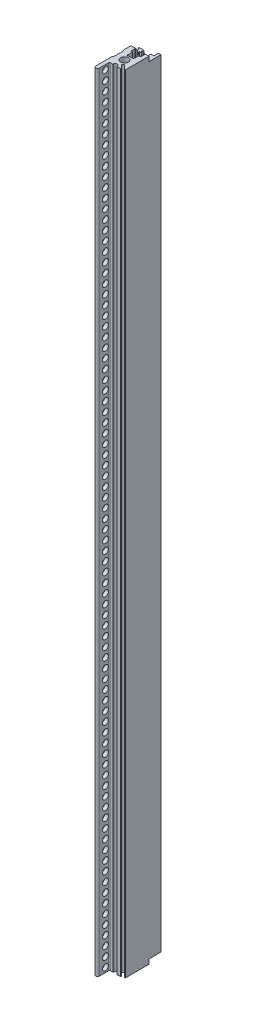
SolidWorks part; units mm, degrees
ref_plane "前视基准面" through (0, 0, 0) normal (0, 0, 1) x (1, 0, 0)
ref_plane "上视基准面" through (0, 0, 0) normal (0, 1, 0) x (1, 0, 0)
ref_plane "右视基准面" through (0, 0, 0) normal (1, 0, 0) x (0, 0, -1)
sketch "草图1" plane through (0, 0, 0) normal (0, 1, 0) x (1, 0, 0)
  line L0 (-4.2, 11.9) -> (-3.9, 11.9)
  line L1 (-4.4, 12.2) -> (-4.4, 12.1)
  line L2 (-4.0328, 12.4) -> (-4.2, 12.4)
  line L3 (-3.85, 12.5) -> (-3.8914, 12.4586)
  line L4 (-2.05, 12.5) -> (-3.85, 12.5)
  line L5 (-2.0086, 12.4586) -> (-2.05, 12.5)
  line L6 (-1.7, 12.4) -> (-1.8672, 12.4)
  line L7 (-1.5, 12.1) -> (-1.5, 12.2)
  line L8 (-1.8, 11.9) -> (-1.7, 11.9)
  line L9 (-2, 11.4828) -> (-2, 11.7)
  line L10 (-1.3586, 10.7586) -> (-1.9414, 11.3414)
  line L11 (-1.3, 10.55) -> (-1.3, 10.6172)
  line L12 (-3.7, 11.7) -> (-3.7, 9.95)
  line L13 (-5, -10.75) -> (-5, -1.6)
  line L14 (-3, -10.75) -> (-3, -5.75)
  line L15 (-2.5, -5.25) -> (-1.15, -5.25)
  line L16 (1.6887, -3.3855) -> (3.2118, -4.9086)
  line L17 (2.5373, -2.537) -> (4.6586, -4.6583)
  line L18 (5, 15) -> (5, 5.1793)
  line L19 (3.6, 15) -> (5, 15)
  line L20 (3.6, 12.5) -> (3.6, 15)
  line L21 (1.95, 12.5) -> (3.6, 12.5)
  line L22 (1.95, 10.55) -> (1.95, 12.5)
  line L23 (2.85, 10.55) -> (1.95, 10.55)
  line L24 (2.85, 9.35) -> (2.85, 10.55)
  line L25 (1.95, 9.35) -> (2.85, 9.35)
  line L26 (1.95, 8.35) -> (1.95, 9.35)
  line L27 (2.85, 8.35) -> (1.95, 8.35)
  line L28 (2.85, 6.05) -> (2.85, 8.35)
  line L29 (1.95, 6.05) -> (2.85, 6.05)
  line L30 (1.95, 3.8856) -> (1.95, 6.05)
  line L31 (-1.45, 6.05) -> (-1.45, 2.9458)
  line L32 (-2.35, 6.05) -> (-1.45, 6.05)
  line L33 (-2.35, 8.35) -> (-2.35, 6.05)
  line L34 (-1.45, 8.35) -> (-2.35, 8.35)
  line L35 (-1.45, 9.35) -> (-1.45, 8.35)
  line L36 (-2.35, 9.35) -> (-1.45, 9.35)
  line L37 (-2.35, 10.55) -> (-2.35, 9.35)
  line L38 (-1.3, 10.55) -> (-2.35, 10.55)
  line L39 (-4.45, 7.7) -> (-4.7, 7.7) construction
  line L40 (-5, 7.4) -> (-4.7, 7.7) construction
  line L41 (-5, 4.4) -> (-5, 7.4)
  line L42 (-4.5499, 3.8998) -> (-5, 4.4)
  line L43 (-4.45, 8.5) -> (-4.45, 9.55)
  line L44 (-3.9, 9.75) -> (-4.25, 9.75)
  line L45 (-4.5499, 3.8998) -> (-4.5501, -1.1002)
  line L46 (-5, -1.6) -> (-4.5501, -1.1002)
  line L47 (4.9414, -1.9395) -> (4.2929, -1.291) construction
  line L48 (5, -2.081) -> (5, -4.5169)
  line L49 (0, 0) -> (0, -5) construction
  line L50 (4, -0.5839) -> (4, 3.6823) construction
  line L51 (-1.05, -5) -> (-1.05, -5.15)
  line L52 (1.05, -5) -> (1.05, -5.15)
  line L53 (1.15, -5.25) -> (3.0703, -5.25)
  line L54 (2.5373, -2.537) -> (1.6887, -3.3855) construction
  line L55 (5, 5.1793) -> (5, -2.081)
  line L56 (-4.45, 8.5) -> (-4.7, 8.5)
  line L57 (-4.7, 8.5) -> (-5, 8.2)
  line L58 (4.9414, 5.0379) -> (4.2929, 4.3894) construction
  line L59 (-5, 8.2) -> (-5, 7.4)
  circle A0 centre (0, 0) radius 1.6
  arc A1 (-4.4, 12.1) -> (-4.2, 11.9) centre (-4.2, 12.1) ccw
  arc A2 (-4.2, 12.4) -> (-4.4, 12.2) centre (-4.2, 12.2) ccw
  arc A3 (-4.0328, 12.4) -> (-3.8914, 12.4586) centre (-4.0328, 12.6) ccw
  arc A4 (-2.0086, 12.4586) -> (-1.8672, 12.4) centre (-1.8672, 12.6) ccw
  arc A5 (-1.5, 12.2) -> (-1.7, 12.4) centre (-1.7, 12.2) ccw
  arc A6 (-1.7, 11.9) -> (-1.5, 12.1) centre (-1.7, 12.1) ccw
  arc A7 (-1.8, 11.9) -> (-2, 11.7) centre (-1.8, 11.7) ccw
  arc A8 (-2, 11.4828) -> (-1.9414, 11.3414) centre (-1.8, 11.4828) ccw
  arc A9 (-1.3, 10.6172) -> (-1.3586, 10.7586) centre (-1.5, 10.6172) ccw
  arc A10 (-5, -10.75) -> (-3, -10.75) centre (-4, -10.75) ccw
  arc A11 (3.0703, -5.25) -> (3.2118, -4.9086) centre (3.0703, -5.05) ccw
  arc A12 (-4.25, 9.75) -> (-4.45, 9.55) centre (-4.25, 9.55) ccw
  arc A13 (-3.9, 9.75) -> (-3.7, 9.95) centre (-3.9, 9.95) ccw
  arc A14 (5, -2.081) -> (4.9414, -1.9395) centre (4.8, -2.081) ccw construction
  arc A15 (4.9414, 5.0379) -> (5, 5.1793) centre (4.8, 5.1793) ccw construction
  arc A16 (4.6586, -4.6583) -> (5, -4.5169) centre (4.8, -4.5169) ccw
  arc A17 (2.5373, -2.537) -> (1.6887, -3.3855) centre (2.113, -2.9613) ccw
  arc A18 (0.7125, 2.9142) -> (-1.1719, 2.7616) centre (0, 0) ccw
  arc A19 (-1.45, 2.9458) -> (-1.1719, 2.7616) centre (-1.25, 2.9458) ccw
  arc A20 (0.7125, 2.9142) -> (1.95, 3.8856) centre (0.95, 3.8856) ccw
  arc A21 (-3.7, 11.7) -> (-3.9, 11.9) centre (-3.9, 11.7) ccw
  arc A22 (4.2929, -1.291) -> (4, -0.5839) centre (5, -0.5839) cw construction
  arc A23 (4, 3.6823) -> (4.2929, 4.3894) centre (5, 3.6823) cw construction
  arc A24 (1.05, -5) -> (-1.05, -5) centre (0, -5) ccw
  arc A25 (1.15, -5.25) -> (1.05, -5.15) centre (1.15, -5.15) cw
  arc A26 (-1.05, -5.15) -> (-1.15, -5.25) centre (-1.15, -5.15) cw
  arc A29 (-3, -5.75) -> (-2.5, -5.25) centre (-2.5, -5.75) cw
  point P104 (1.05, -5.25)
  dimension "D1" = 3.2
  dimension "D2" = 2.1
  dimension "D3" = 5.2
  dimension "D4" = 45
  dimension "D5" = 1.2
  dimension "D7" = 0.6
  dimension "D8" = 0.2
  dimension "D10" = 5
  dimension "D11" = 0.1
  dimension "D12" = 0.25
  dimension "D6" = 3
  dimension "D9" = 2.1225
  dimension "D13" = 0.8
extrude "凸台-拉伸1" add sketch "草图1" along normal mid plane 431.8
sketch "草图7" plane through (0, 215.9, 0) normal (0, 1, 0) x (1, 0, 0)
  line L0 (1.95, 8.35) -> (2.85, 8.35) construction
  line L1 (2.95, 8.35) -> (-2.45, 8.35)
  line L2 (2.95, 8.35) -> (2.95, 5.85)
  line L3 (2.95, 5.85) -> (-2.45, 5.85)
  line L4 (-2.45, 8.35) -> (-2.45, 5.85)
  line L5 (1.95, 10.55) -> (2.85, 10.55) construction
  line L6 (2.95, 10.55) -> (-2.45, 10.55)
  line L7 (2.95, 10.55) -> (2.95, 9.35)
  line L8 (2.95, 9.35) -> (-2.45, 9.35)
  line L9 (-2.45, 10.55) -> (-2.45, 9.35)
  line L10 (-1.45, 9.35) -> (-2.35, 9.35) construction
  line L11 (2.85, 8.35) -> (2.85, 6.05) construction
  line L12 (-2.35, 6.05) -> (-2.35, 8.35) construction
  line L13 (-1.45, 6.05) -> (-2.35, 6.05) construction
  dimension "D1" = 0.1
  dimension "D2" = 0.1
  dimension "D3" = 0.2
extrude "切除-拉伸6" cut sketch "草图7" against normal through all
fillet "圆角1" radius 0.2 8 edges at (2.95, 0, -5.85) (2.95, 0, -8.35) (-2.45, 0, -5.85) (-2.45, 0, -8.35) (-2.45, 0, -9.35) (-2.45, 0, -10.55) (2.95, 0, -9.35) (2.95, 0, -10.55)
sketch "草图2" plane through (0, 215.9, 0) normal (0, 1, 0) x (1, 0, 0)
  circle A0 centre (0, 0) radius 2.1
  dimension "D1" = 4.2
extrude "切除-拉伸1" cut sketch "草图2" against normal blind 10
sketch "草图3" plane through (0, -215.9, 0) normal (0, -1, 0) x (1, 0, 0)
  circle A0 centre (0, 0) radius 2.1
  dimension "D1" = 4.2
extrude "切除-拉伸2" cut sketch "草图3" against normal blind 10
sketch "草图4" plane through (-5, 0, 0) normal (-1, 0, 0) x (0, 0, 1)
  line L0 (1.6, -215.9) -> (10.75, -215.9) construction
  line L1 (11.75, -215.9) -> (11.75, 215.9) construction
  circle A0 centre (7.5, -213.36) radius 1.65
  circle A1 centre (7.5, -208.28) radius 1.65
  circle A2 centre (7.5, -203.2) radius 1.65
  circle A3 centre (7.5, -198.12) radius 1.65
  circle A4 centre (7.5, -193.04) radius 1.65
  circle A5 centre (7.5, -187.96) radius 1.65
  circle A6 centre (7.5, -182.88) radius 1.65
  circle A7 centre (7.5, -177.8) radius 1.65
  circle A8 centre (7.5, -172.72) radius 1.65
  circle A9 centre (7.5, -167.64) radius 1.65
  circle A10 centre (7.5, -162.56) radius 1.65
  circle A11 centre (7.5, -157.48) radius 1.65
  circle A12 centre (7.5, -152.4) radius 1.65
  circle A13 centre (7.5, -147.32) radius 1.65
  circle A14 centre (7.5, -142.24) radius 1.65
  circle A15 centre (7.5, -137.16) radius 1.65
  circle A16 centre (7.5, -132.08) radius 1.65
  circle A17 centre (7.5, -127) radius 1.65
  circle A18 centre (7.5, -121.92) radius 1.65
  circle A19 centre (7.5, -116.84) radius 1.65
  circle A20 centre (7.5, -111.76) radius 1.65
  circle A21 centre (7.5, -106.68) radius 1.65
  circle A22 centre (7.5, -101.6) radius 1.65
  circle A23 centre (7.5, -96.52) radius 1.65
  circle A24 centre (7.5, -91.44) radius 1.65
  circle A25 centre (7.5, -86.36) radius 1.65
  circle A26 centre (7.5, -81.28) radius 1.65
  circle A27 centre (7.5, -76.2) radius 1.65
  circle A28 centre (7.5, -71.12) radius 1.65
  circle A29 centre (7.5, -66.04) radius 1.65
  circle A30 centre (7.5, -60.96) radius 1.65
  circle A31 centre (7.5, -55.88) radius 1.65
  circle A32 centre (7.5, -50.8) radius 1.65
  circle A33 centre (7.5, -45.72) radius 1.65
  circle A34 centre (7.5, -40.64) radius 1.65
  circle A35 centre (7.5, -35.56) radius 1.65
  circle A36 centre (7.5, -30.48) radius 1.65
  circle A37 centre (7.5, -25.4) radius 1.65
  circle A38 centre (7.5, -20.32) radius 1.65
  circle A39 centre (7.5, -15.24) radius 1.65
  circle A40 centre (7.5, -10.16) radius 1.65
  circle A41 centre (7.5, -5.08) radius 1.65
  circle A42 centre (7.5, 0) radius 1.65
  circle A43 centre (7.5, 5.08) radius 1.65
  circle A44 centre (7.5, 10.16) radius 1.65
  circle A45 centre (7.5, 15.24) radius 1.65
  circle A46 centre (7.5, 20.32) radius 1.65
  circle A47 centre (7.5, 25.4) radius 1.65
  circle A48 centre (7.5, 30.48) radius 1.65
  circle A49 centre (7.5, 35.56) radius 1.65
  circle A50 centre (7.5, 40.64) radius 1.65
  circle A51 centre (7.5, 45.72) radius 1.65
  circle A52 centre (7.5, 50.8) radius 1.65
  circle A53 centre (7.5, 55.88) radius 1.65
  circle A54 centre (7.5, 60.96) radius 1.65
  circle A55 centre (7.5, 66.04) radius 1.65
  circle A56 centre (7.5, 71.12) radius 1.65
  circle A57 centre (7.5, 76.2) radius 1.65
  circle A58 centre (7.5, 81.28) radius 1.65
  circle A59 centre (7.5, 86.36) radius 1.65
  circle A60 centre (7.5, 91.44) radius 1.65
  circle A61 centre (7.5, 96.52) radius 1.65
  circle A62 centre (7.5, 101.6) radius 1.65
  circle A63 centre (7.5, 106.68) radius 1.65
  circle A64 centre (7.5, 111.76) radius 1.65
  circle A65 centre (7.5, 116.84) radius 1.65
  circle A66 centre (7.5, 121.92) radius 1.65
  circle A67 centre (7.5, 127) radius 1.65
  circle A68 centre (7.5, 132.08) radius 1.65
  circle A69 centre (7.5, 137.16) radius 1.65
  circle A70 centre (7.5, 142.24) radius 1.65
  circle A71 centre (7.5, 147.32) radius 1.65
  circle A72 centre (7.5, 152.4) radius 1.65
  circle A73 centre (7.5, 157.48) radius 1.65
  circle A74 centre (7.5, 162.56) radius 1.65
  circle A75 centre (7.5, 167.64) radius 1.65
  circle A76 centre (7.5, 172.72) radius 1.65
  circle A77 centre (7.5, 177.8) radius 1.65
  circle A78 centre (7.5, 182.88) radius 1.65
  circle A79 centre (7.5, 187.96) radius 1.65
  circle A80 centre (7.5, 193.04) radius 1.65
  circle A81 centre (7.5, 198.12) radius 1.65
  circle A82 centre (7.5, 203.2) radius 1.65
  circle A83 centre (7.5, 208.28) radius 1.65
  circle A84 centre (7.5, 213.36) radius 1.65
  dimension "D1" = 2.54
  dimension "D2" = 4.25
  dimension "D3" = 3.3
  dimension "D5" = 5.08
  dimension "D4" = 85
extrude "切除-拉伸3" cut sketch "草图4" against normal blind 12
sketch "草图5" plane through (5, 0, 0) normal (1, 0, 0) x (0, 0, -1)
  line L0 (15, 0) -> (41.1348, 0) construction
  line L1 (15, 215.9) -> (8.5, 215.9)
  line L2 (15, 215.9) -> (15, 213.36)
  line L3 (15, 213.36) -> (8.5, 213.36)
  line L4 (8.5, 215.9) -> (8.5, 213.36)
  line L5 (15, 215.9) -> (15, -215.9) construction
  line L6 (8.5, -215.9) -> (8.5, -213.36)
  line L7 (15, -213.36) -> (8.5, -213.36)
  line L8 (15, -215.9) -> (15, -213.36)
  line L9 (15, -215.9) -> (8.5, -215.9)
  dimension "D1" = 6.5
  dimension "D2" = 2.54
extrude "切除-拉伸4" cut sketch "草图5" against normal blind 10
